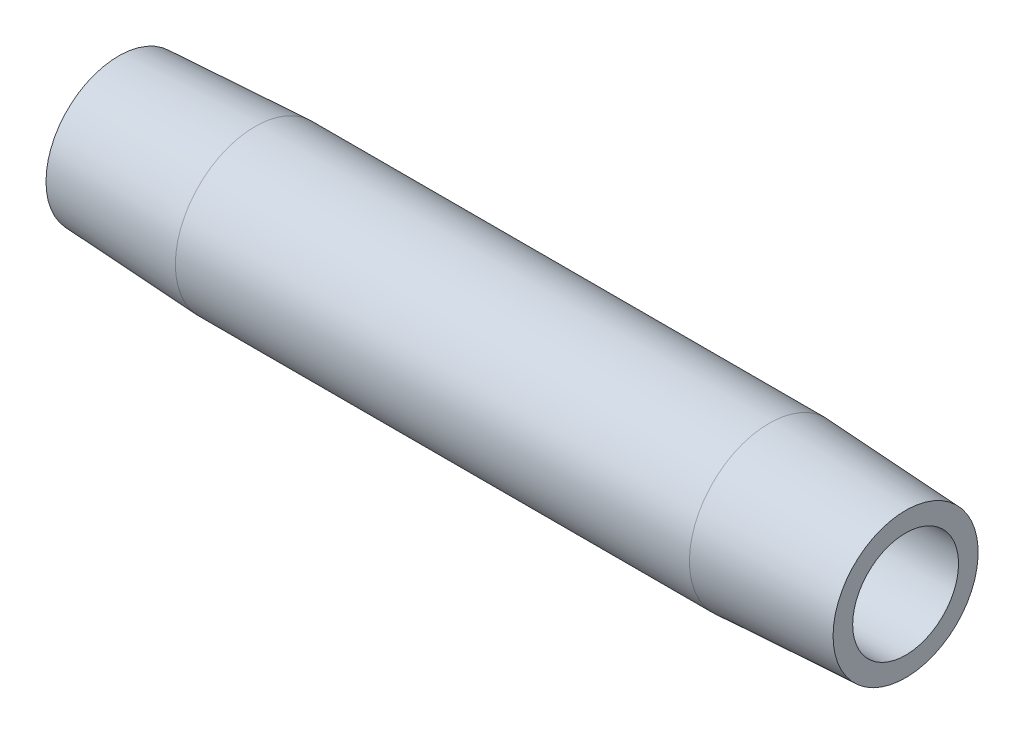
SolidWorks part; units mm, degrees
ref_plane "Front Plane" through (0, 0, 0) normal (0, 0, 1) x (1, 0, 0)
ref_plane "Top Plane" through (0, 0, 0) normal (0, 1, 0) x (1, 0, 0)
ref_plane "Right Plane" through (0, 0, 0) normal (1, 0, 0) x (0, 0, -1)
sketch "Sketch2" plane through (0, 0, 0) normal (0, 0, 1) x (1, 0, 0)
  line L0 (0.4761, 0) -> (50000.4761, 0) construction
  line L1 (0, -11.3625) -> (0, 49988.6375) construction
  line L7 (8.81, 5.1435) -> (0, 4.6818)
  line L8 (41.99, 5.1435) -> (8.81, 5.1435)
  line L9 (50.8, 4.6818) -> (41.99, 5.1435)
  line L10 (50.8, 3.4163) -> (50.8, 4.6818)
  line L11 (50.8, 3.4163) -> (0, 3.4163)
  line L12 (0, 4.6818) -> (0, 3.4163)
  dimension "D1" = 6.8326
  dimension "D2" = 10.287
  dimension "D3" = 3
  dimension "D4" = 3
  dimension "D5" = 8.81
  dimension "D6" = 8.81
  dimension "D7" = 50.8
revolve "Revolve1" add sketch "Sketch2" angle 360 about L0
